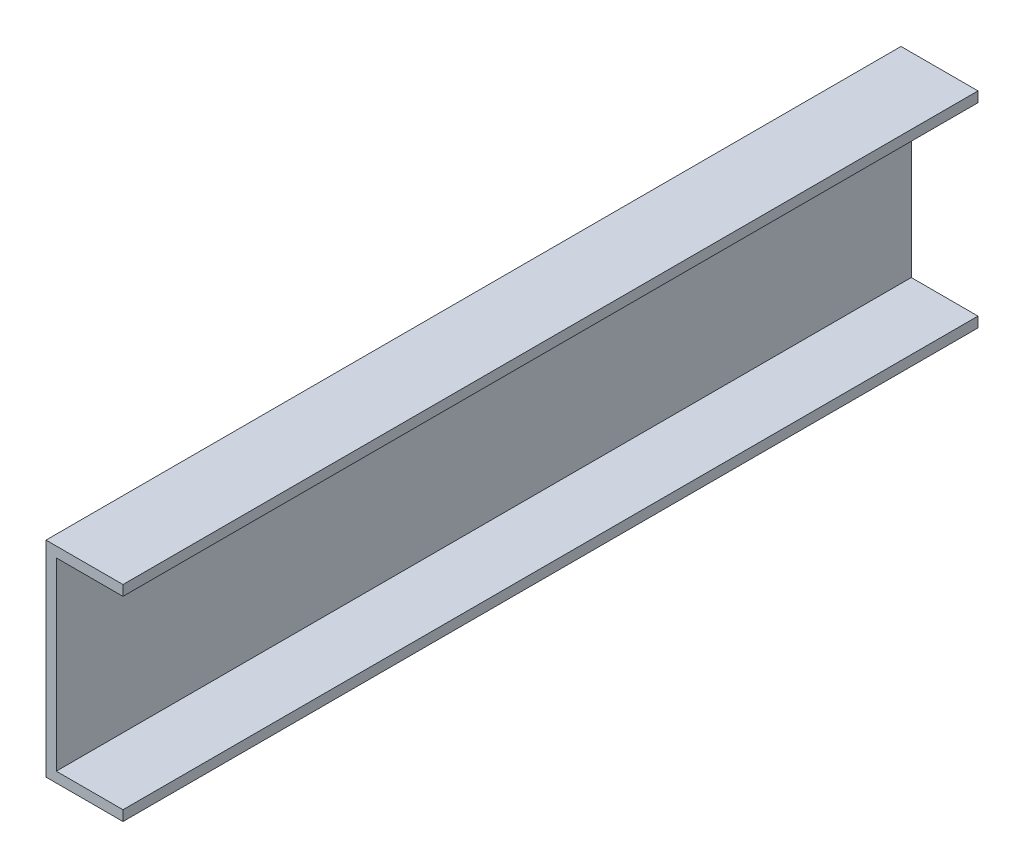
SolidWorks part; units mm, degrees
ref_plane "Front Plane" through (0, 0, 0) normal (0, 0, 1) x (1, 0, 0)
ref_plane "Top Plane" through (0, 0, 0) normal (0, 1, 0) x (1, 0, 0)
ref_plane "Right Plane" through (0, 0, 0) normal (1, 0, 0) x (0, 0, -1)
sketch "Sketch1" plane through (0, 0, 0) normal (0, 0, 1) x (1, 0, 0)
  line L0 (75, 0) -> (0, 0)
  line L1 (0, 0) -> (0, 200)
  line L2 (0, 200) -> (75, 200)
  line L3 (75, 200) -> (75, 190)
  line L4 (75, 190) -> (10, 190)
  line L5 (10, 190) -> (10, 10)
  line L6 (10, 10) -> (75, 10)
  line L7 (75, 10) -> (75, 0)
  dimension "D1" = 200
  dimension "D2" = 75
  dimension "D3" = 10
  dimension "D4" = 10
extrude "Boss-Extrude1" add sketch "Sketch1" along normal mid plane 833
